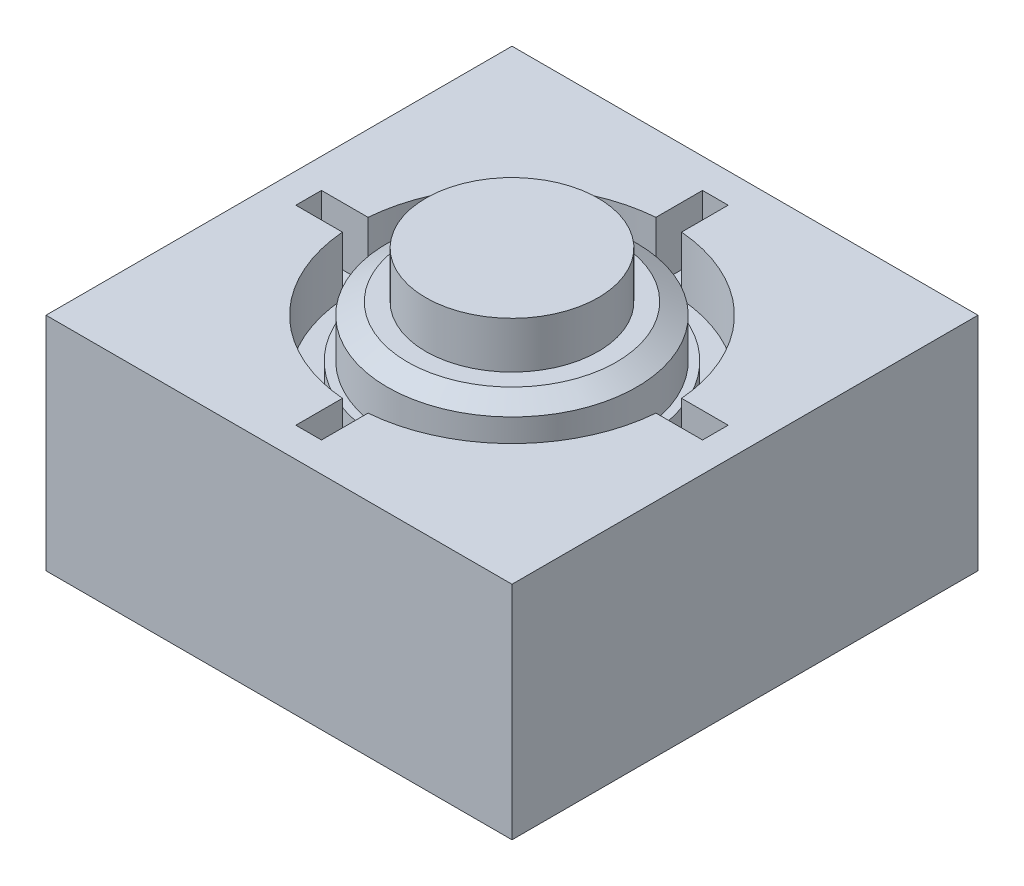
SolidWorks part; units mm, degrees
ref_plane "Front Plane" through (0, 0, 0) normal (0, 0, 1) x (1, 0, 0)
ref_plane "Top Plane" through (0, 0, 0) normal (0, 1, 0) x (1, 0, 0)
ref_plane "Right Plane" through (0, 0, 0) normal (1, 0, 0) x (0, 0, -1)
sketch "Sketch1" plane through (0, 0, 0) normal (0, 1, 0) x (1, 0, 0)
  line L1 (-10, 10) -> (10, 10)
  line L2 (-10, 10) -> (-10, -10)
  line L3 (-10, -10) -> (10, -10)
  line L4 (10, 10) -> (10, -10)
  dimension "D1" = 20
  dimension "D2" = 20
  dimension "D3" = 10
  dimension "D4" = 10
extrude "Boss-Extrude1" add sketch "Sketch1" along normal blind 10
sketch "Sketch3" plane through (0, 10, 0) normal (0, 1, 0) x (1, 0, 0)
  circle A0 centre (0, 0) radius 6.75
  circle A1 centre (0, 0) radius 5.35
  dimension "D1" = 13.5
  dimension "D2" = 10.7
extrude "Cut-Extrude1" cut sketch "Sketch3" against normal blind 3
fillet "Fillet1" [suppressed] radius 0.7
sketch "Sketch5" plane through (0, 7, 0) normal (0, 1, 0) x (1, 0, 0)
  circle A0 centre (0, 0) radius 5.7
  dimension "D1" = 11.4
extrude "Boss-Extrude2" add sketch "Sketch5" along normal blind 0.8
sketch "Sketch6" plane through (0, 10, 0) normal (0, 1, 0) x (1, 0, 0)
  line L1 (-0.55, 8.7276) -> (0.55, 8.7276)
  line L2 (-0.55, 8.7276) -> (-0.55, 6.7276)
  line L3 (-0.55, 6.7276) -> (0.55, 6.7276)
  line L4 (0.55, 8.7276) -> (0.55, 6.7276)
  line L5 (-0.55, -6.7276) -> (0.55, -6.7276)
  line L6 (-0.55, -6.7276) -> (-0.55, -8.7276)
  line L7 (-0.55, -8.7276) -> (0.55, -8.7276)
  line L8 (0.55, -6.7276) -> (0.55, -8.7276)
  circle A0 centre (0, 0) radius 6.75 construction
  dimension "D1" = 0.55
  dimension "D2" = 1.1
  dimension "D3" = 0.55
  dimension "D4" = 1.1
  dimension "D5" = 2
  dimension "D6" = 2
extrude "Cut-Extrude2" cut sketch "Sketch6" against normal blind 3
sketch "Sketch7" plane through (0, 0, 0) normal (0, 0, 1) x (1, 0, 0)
  line L0 (0, 0) -> (0, 12.3386) construction
pattern_circular "CirPattern1" count 2 every 90 about axis through (0, 0, 0) along (0, 1, 0) of "Cut-Extrude2"
chamfer "Chamfer1" distance 0.5 angle 60 1 edges at (0, 10, 5.35)
sketch "Sketch9" plane through (0, 10, 0) normal (0, 1, 0) x (1, 0, 0)
  circle A0 centre (0, 0) radius 3.7
extrude "Boss-Extrude3" add sketch "Sketch9" along normal blind 2
ref_plane "Plane1" through (0, 12, 0) normal (0, 1, 0) x (1, 0, 0)
sketch "Sketch11" plane through (0, 12, 0) normal (0, 1, 0) x (1, 0, 0)
  line L1 (-10.37, 10.3853) -> (10.278, 10.3853)
  line L2 (-10.37, 10.3853) -> (-10.37, -10.416)
  line L3 (-10.37, -10.416) -> (10.278, -10.416)
  line L4 (10.278, 10.3853) -> (10.278, -10.416)
  circle A0 centre (0, 0) radius 5.35
  dimension "D1" = 10.7
extrude "Cut-Extrude3" cut sketch "Sketch11" against normal blind 2.5
